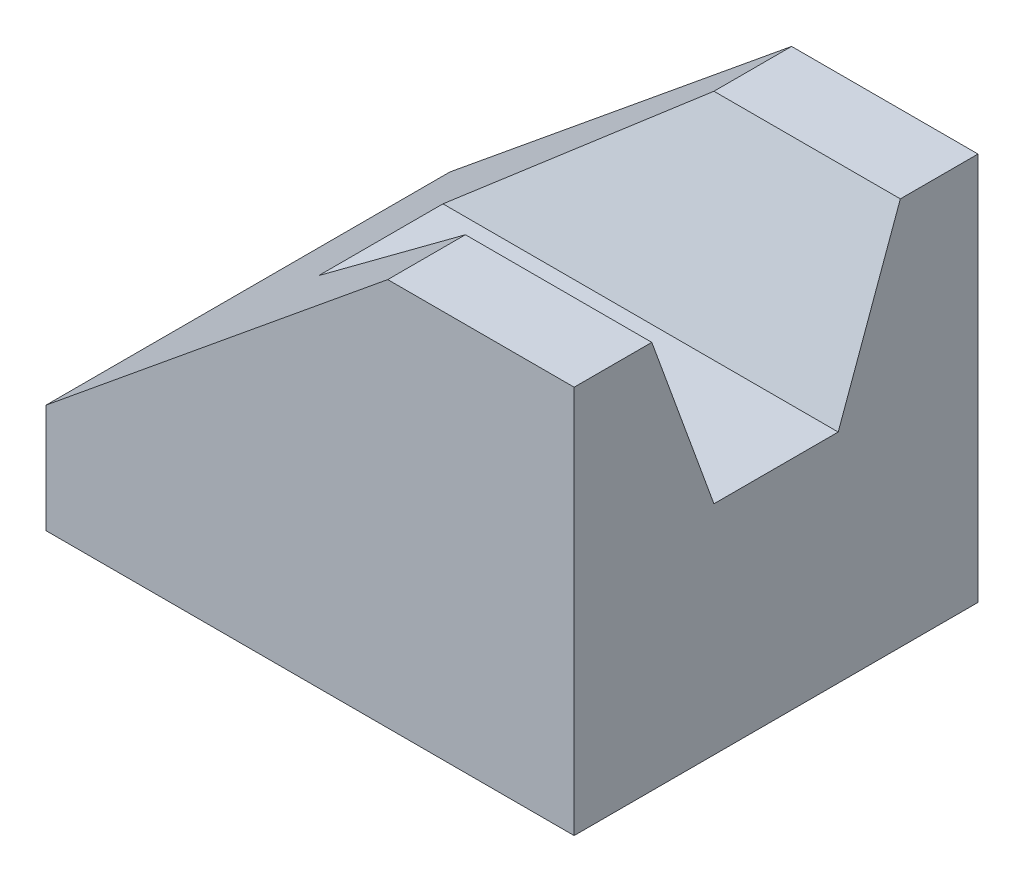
SolidWorks part; units mm, degrees
ref_plane "前视基准面" through (0, 0, 0) normal (0, 0, 1) x (1, 0, 0)
ref_plane "上视基准面" through (0, 0, 0) normal (0, 1, 0) x (1, 0, 0)
ref_plane "右视基准面" through (0, 0, 0) normal (1, 0, 0) x (0, 0, -1)
sketch "草图1" plane through (0, 0, 0) normal (0, 1, 0) x (1, 0, 0)
  line L0 (0, 0) -> (-68, 0)
  line L1 (-68, 0) -> (-68, -52)
  line L2 (-68, -52) -> (0, -52)
  line L3 (0, -52) -> (0, 0)
  dimension "D1" = 68
  dimension "D2" = 52
extrude "凸台-拉伸1" add sketch "草图1" along normal blind 50
sketch "草图2" plane through (0, 0, 0) normal (0, 0, 1) x (1, 0, 0)
  line L0 (-24, 50) -> (-68, 14)
  line L1 (-68, 50) -> (0, 50) construction
  line L2 (-68, 50) -> (-68, 0) construction
  line L3 (-68, 14) -> (-68, 50)
  line L4 (-68, 50) -> (-24, 50)
  dimension "D1" = 24
  dimension "D2" = 14
extrude "切除-拉伸1" cut sketch "草图2" along normal through all
sketch "草图3" plane through (0, 0, 0) normal (1, 0, 0) x (0, 0, -1)
  line L0 (-26, 50) -> (-26, 12.1287) construction
  line L1 (-52, 50) -> (0, 50) construction
  line L2 (-18, 28) -> (-34, 28)
  line L3 (-34, 28) -> (-42, 50)
  line L4 (-42, 50) -> (-10, 50)
  line L5 (-18, 28) -> (-10, 50)
  point P8 (-26, 28)
  dimension "D1" = 22
  dimension "D2" = 16
  dimension "D3" = 8
extrude "切除-拉伸2" cut sketch "草图3" against normal through all
